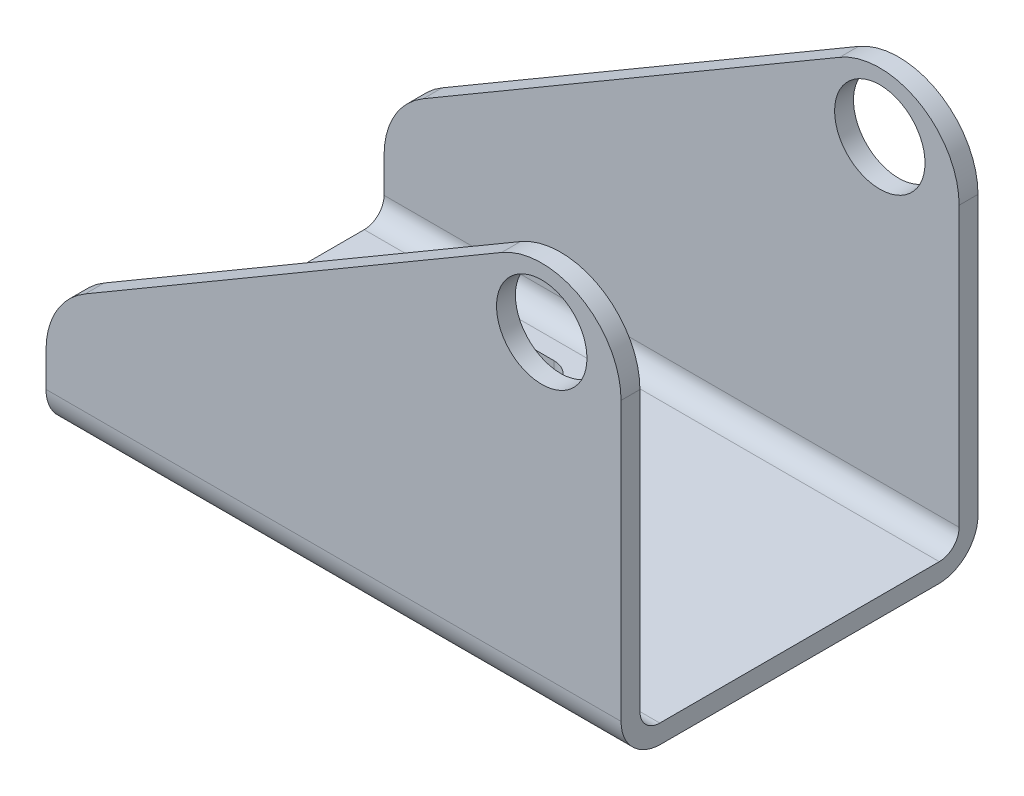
SolidWorks part; units mm, degrees
ref_plane "Front" through (0, 0, 0) normal (0, 0, 1) x (1, 0, 0)
ref_plane "Top" through (0, 0, 0) normal (0, 1, 0) x (1, 0, 0)
ref_plane "Right" through (0, 0, 0) normal (1, 0, 0) x (0, 0, -1)
sketch "Sketch1"
  dimension "D1" = 92.075
  dimension "D2" = 19.05
  dimension "D3" = 73.025
extrude "Base-Extrude" add sketch "Sketch1" along normal mid plane 57.15
fillet "Fillet1" radius 12.7
fillet "Fillet2" radius 12.7
shell "Shell1" thickness 3.0226
hole_wizard "9/16 Clearance Hole1" positions "Sketch3" profile "Sketch2" hole size "9/16" standard "Ansi Inch"
sketch "Sketch3"
  dimension "D1" = 12.7
  dimension "D2" = 53.975
sketch "Sketch2"
  dimension "Thru Hole Dia." = 14.478
  dimension "Thru Hole Depth" = 57.15
fillet "Fillet3" radius 6.35
fillet "Fillet4" radius 3.175
sketch "Sketch4"
  dimension "D3" = 3.5306
  dimension "D1" = 15.875
  dimension "D2" = 6.35
  dimension "D4" = 11.1125
extrude "Cut-Extrude1" cut sketch "Sketch4" against normal through all
pattern_linear "LPattern1" count 2 spacing 19.05 count 2 spacing 31.75
